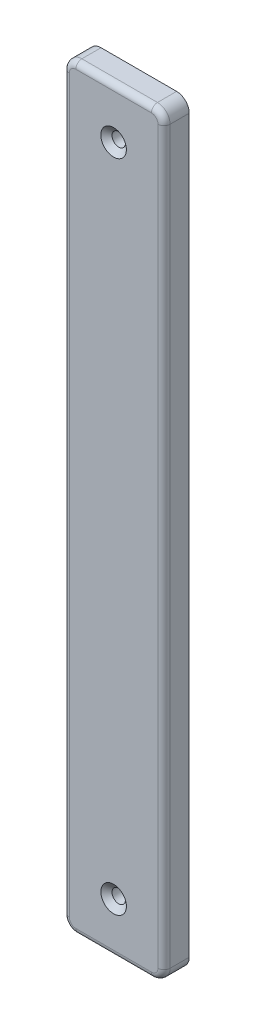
SolidWorks part; units mm, degrees
ref_plane "Front" through (0, 0, 0) normal (0, 0, 1) x (1, 0, 0)
ref_plane "Top" through (0, 0, 0) normal (0, 1, 0) x (1, 0, 0)
ref_plane "Right" through (0, 0, 0) normal (1, 0, 0) x (0, 0, -1)
sketch "Sketch1" plane through (0, 0, 0) normal (0, 0, 1) x (1, 0, 0)
  line L0 (0, 190.5) -> (0, -190.5) construction
  line L1 (25.4, -190.5) -> (-25.4, -190.5)
  line L2 (25.4, -190.5) -> (25.4, 190.5)
  line L3 (-25.4, 190.5) -> (25.4, 190.5)
  line L4 (-25.4, 190.5) -> (-25.4, -190.5)
  dimension "D1" = 381
  dimension "D3" = 50.8
extrude "Base-Extrude" add sketch "Sketch1" along normal blind 12.7
sketch "Sketch2" plane through (0, 0, 12.7) normal (0, 0, 1) x (1, 0, 0)
  line L0 (0, 0) -> (71.1, 0) construction
  line L1 (0, 190.5) -> (0, -190.5) construction
  line L2 (-25.4, 190.5) -> (25.4, 190.5) construction
  line L3 (25.4, -190.5) -> (-25.4, -190.5) construction
  point P0 (0, -165.1)
  point P2 (0, 165.1)
  dimension "D1" = 330.2
hole_wizard "CSK for 1/4 Flat Head Machine Screw (100)1" positions "Sketch5" profile "Sketch4" countersink size "1/4" standard "Ansi Inch"
sketch "Sketch5" plane through (0, 0, 12.7) normal (0, 0, 1) x (1, 0, 0)
  point P0 (0, 165.1)
  point P1 (0, -165.1)
sketch "Sketch4" plane through (0, 165.1, 12.7) normal (1, 0, 0) x (0, -1, 0)
  line L0 (0, 0) -> (0, 12.7)
  line L1 (0, 12.7) -> (3.3782, 12.7)
  line L2 (3.3782, 12.7) -> (3.3782, 2.5682)
  line L3 (3.3782, 2.5682) -> (6.4389, 0)
  line L5 (6.4389, 0) -> (0, 0)
  line L6 (-3.3782, 2.5682) -> (-6.4389, 0) construction
  line L11 (0, -6.35) -> (0, 107.95) construction
  dimension "Thru Hole Dia." = 6.7564
  dimension "Thru Hole Depth" = 12.7
  dimension "Near C'Sink Dia." = 12.8778
  dimension "Near C'Sink Angle" = 100
fillet "Fillet1" radius 6.35 4 edges at (25.4, -190.5, 6.35) (-25.4, -190.5, 6.35) (-25.4, 190.5, 6.35) (25.4, 190.5, 6.35)
fillet "Fillet2" radius 3.048 8 edges at (-23.5401, 188.6401, 12.7) (0, 190.5, 12.7) (23.5401, 188.6401, 12.7) (25.4, 0, 12.7) (23.5401, -188.6401, 12.7) (0, -190.5, 12.7) (-23.5401, -188.6401, 12.7) (-25.4, 0, 12.7)
